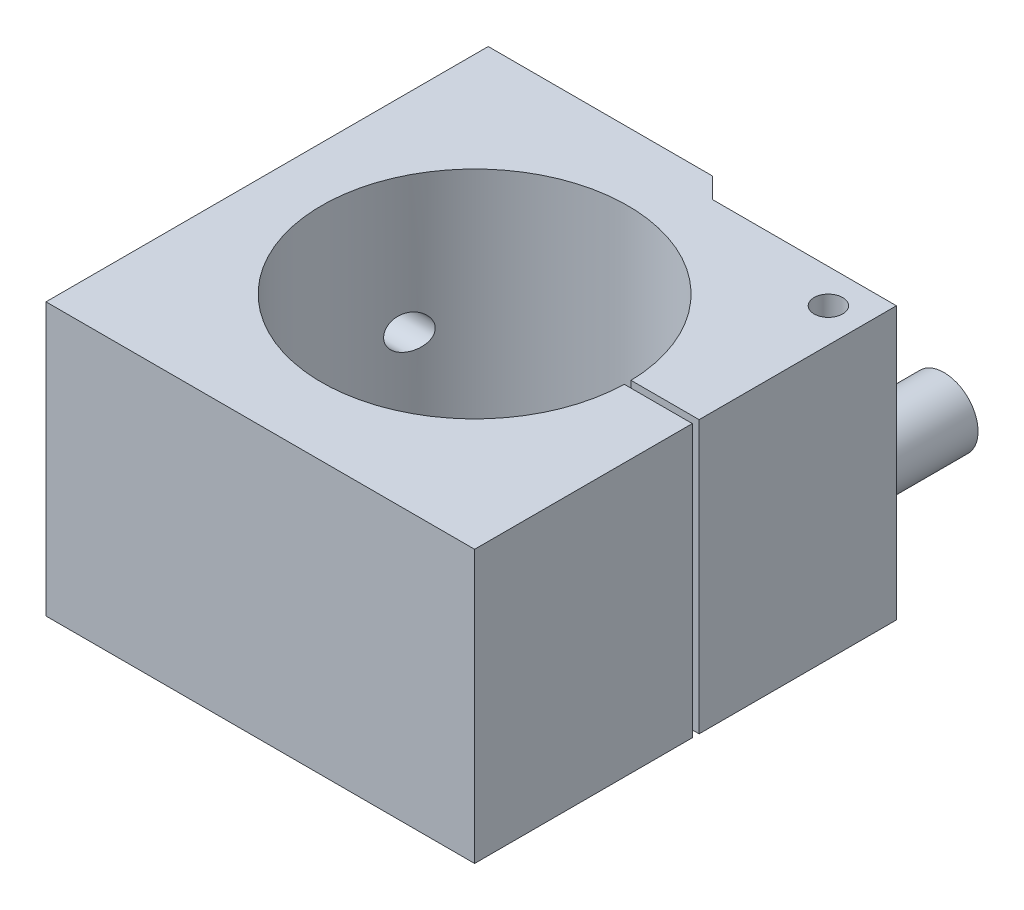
SolidWorks part; units mm, degrees
ref_plane "Front Plane" through (0, 0, 0) normal (0, 0, 1) x (1, 0, 0)
ref_plane "Top Plane" through (0, 0, 0) normal (0, 1, 0) x (1, 0, 0)
ref_plane "Right Plane" through (0, 0, 0) normal (1, 0, 0) x (0, 0, -1)
sketch "Sketch1" plane through (0, 0, 0) normal (0, 1, 0) x (1, 0, 0)
  line L1 (-32.5, -32.5) -> (32.5, -32.5)
  line L2 (-32.5, -32.5) -> (-32.5, 32.5)
  line L3 (-32.5, 32.5) -> (32.5, 32.5)
  line L4 (32.5, -32.5) -> (32.5, 32.5)
  line L5 (-32.5, -32.5) -> (32.5, 32.5) construction
  line L6 (-32.5, 32.5) -> (32.5, -32.5) construction
  point P0 (0, 0)
  dimension "D1" = 65
extrude "Boss-Extrude1" add sketch "Sketch1" along normal blind 40
sketch "Sketch2" plane through (0, 40, 0) normal (0, 1, 0) x (1, 0, 0)
  circle A0 centre (0, 0) radius 22.5
  dimension "D1" = 45
extrude "Cut-Extrude1" cut sketch "Sketch2" against normal up to next
sketch "Sketch3" plane through (32.5, 0, 0) normal (1, 0, 0) x (0, 0, -1)
  line L0 (0, 40) -> (0, 0) construction
  line L1 (-32.5, 40) -> (32.5, 40) construction
  line L2 (-32.5, 0) -> (32.5, 0) construction
  line L3 (-0.5, 40) -> (-0.5, 0)
  line L4 (-0.5, 0) -> (0.5, 0)
  line L5 (0.5, 0) -> (0.5, 40)
  line L6 (0.5, 40) -> (-0.5, 40)
  dimension "D1" = 0.5
  dimension "D2" = 1
extrude "Cut-Extrude2" cut sketch "Sketch3" against normal up to next
sketch "Sketch5" plane through (-32.5, 0, 0) normal (-1, 0, 0) x (0, 0, 1)
  line L0 (-32.5, 0) -> (32.5, 0) construction
  line L1 (32.5, 40) -> (32.5, 0) construction
  line L2 (-32.5, 40) -> (32.5, 40) construction
  line L3 (-32.5, 40) -> (-32.5, 0) construction
  line L4 (-32.5, 0) -> (32.5, 0)
  line L5 (32.5, 40) -> (32.5, 0)
  line L6 (-32.5, 40) -> (32.5, 40)
  line L7 (-32.5, 40) -> (-32.5, 0)
extrude "Cut-Extrude3" cut sketch "Sketch5" against normal blind 5
sketch "Sketch7" plane through (0, 0, -32.5) normal (0, 0, -1) x (-1, 0, 0)
  line L0 (-32.5, 0) -> (27.5, 0) construction
  line L1 (-32.5, 40) -> (-12.5, 40)
  line L2 (-32.5, 40) -> (-32.5, 0)
  line L3 (-32.5, 0) -> (-12.5, 0)
  line L4 (-12.5, 40) -> (-12.5, 0)
  dimension "D1" = 20
extrude "Cut-Extrude4" cut sketch "Sketch7" against normal blind 3
chamfer "Chamfer1" distance 10 angle 45 1 edges at (12.5, 20, -32.5)
sketch "Sketch8" plane through (0, 0, -29.5) normal (0, 0, -1) x (-1, 0, 0)
  line L0 (-32.5, 0) -> (-5.5, 0) construction
  line L1 (-32.5, 40) -> (-32.5, 0) construction
  circle A0 centre (-19.5, 10) radius 5
  dimension "D3" = 10
  dimension "D1" = 10
  dimension "D2" = 13
extrude "Boss-Extrude2" add sketch "Sketch8" along normal blind 20
sketch "Sketch9" plane through (0, 0, -29.5) normal (0, 0, -1) x (-1, 0, 0)
  line L0 (-5.5, 0) -> (-5.5, 40) construction
  line L1 (-5.5, 40) -> (-32.5, 40) construction
  line L2 (-5.5, 0) -> (-5.5, 40)
  line L3 (-5.5, 40) -> (-32.5, 40)
  circle A0 centre (-13.5, 32) radius 5
  dimension "D1" = 10
  dimension "D2" = 8
  dimension "D3" = 8
extrude "Cut-Extrude5" cut sketch "Sketch9" against normal blind 7.5 contours A0
sketch "Sketch10" plane through (0, 40, 0) normal (0, 1, 0) x (1, 0, 0)
  line L0 (32.5, 0.5) -> (32.5, 29.5) construction
  line L1 (5.5, 29.5) -> (32.5, 29.5) construction
  circle A0 centre (27.5, 24.5) radius 2.1
  dimension "D1" = 4.2
  dimension "D2" = 5
  dimension "D3" = 5
extrude "Cut-Extrude6" cut sketch "Sketch10" against normal blind 10
sketch "Sketch12" plane through (-27.5, 0, 0) normal (-1, 0, 0) x (0, 0, 1)
  line L0 (0, 40) -> (0, 0) construction
  line L1 (32.5, 40) -> (-32.5, 40) construction
  line L2 (-32.5, 0) -> (32.5, 0) construction
  line L3 (-10.25, 20) -> (0, 20) construction
  line L5 (0, 20) -> (10.25, 20) construction
  circle A0 centre (-10.25, 20) radius 2.5
  circle A1 centre (10.25, 20) radius 2.5
  dimension "D1" = 5
  dimension "D2" = 10.25
extrude "Cut-Extrude8" cut sketch "Sketch12" against normal blind 10
sketch "Sketch13" plane through (-27.5, 0, 0) normal (-1, 0, 0) x (0, 0, 1)
  line L4 (-32.5, 40) -> (-32.5, 0)
  line L5 (-32.5, 0) -> (32.5, 0)
  line L6 (32.5, 0) -> (32.5, 40)
  line L7 (32.5, 40) -> (-32.5, 40)
  line L8 (-32.5, 40) -> (-32.5, 0)
  line L9 (-32.5, 0) -> (32.5, 0)
  line L10 (32.5, 0) -> (32.5, 40)
  line L11 (32.5, 40) -> (-32.5, 40)
  circle A0 centre (-10.25, 20) radius 2.5 construction
  circle A1 centre (10.25, 20) radius 2.5 construction
  circle A2 centre (-10.25, 20) radius 2.5
  circle A3 centre (10.25, 20) radius 2.5
  dimension "D1" = 0
extrude "Boss-Extrude3" add sketch "Sketch13" along normal blind 3
